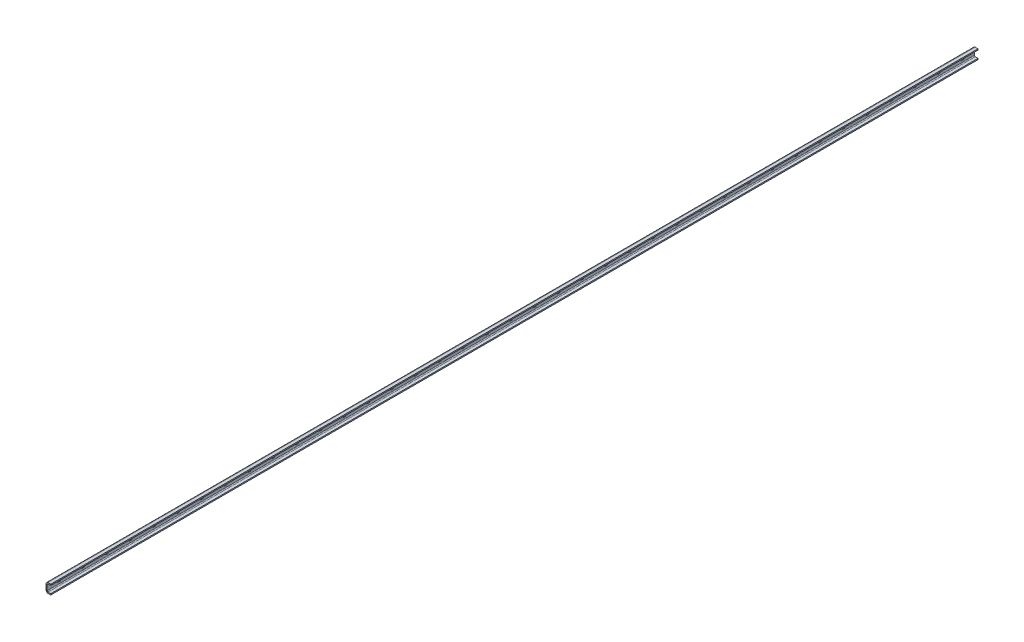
SolidWorks part; units mm, degrees
ref_plane "Front Plane" through (0, 0, 0) normal (0, 0, 1) x (1, 0, 0)
ref_plane "Top Plane" through (0, 0, 0) normal (0, 1, 0) x (1, 0, 0)
ref_plane "Right Plane" through (0, 0, 0) normal (1, 0, 0) x (0, 0, -1)
sketch "Sketch1" plane through (0, 0, 0) normal (0, 0, 1) x (1, 0, 0)
  line L0 (16, 11.9) -> (16, 15.9)
  line L1 (16, 15.9) -> (7, 15.9)
  line L2 (0, 8.9) -> (0, -8.9)
  line L3 (7, -15.9) -> (16, -15.9)
  line L4 (16, -15.9) -> (16, -11.9)
  line L5 (16, -11.9) -> (7, -11.9)
  line L6 (4, -8.9) -> (4, 8.9)
  line L7 (7, 11.9) -> (16, 11.9)
  arc A0 (7, 15.9) -> (0, 8.9) centre (7, 8.9) ccw
  arc A1 (0, -8.9) -> (7, -15.9) centre (7, -8.9) ccw
  arc A2 (7, -11.9) -> (4, -8.9) centre (7, -8.9) cw
  arc A3 (4, 8.9) -> (7, 11.9) centre (7, 8.9) cw
  dimension "D1" = 7
  dimension "D2" = 3
  dimension "D3" = 16
  dimension "D4" = 11.9
  dimension "D5" = 11.9
extrude "Extrude1" add sketch "Sketch1" against normal blind 3120
sketch "Sketch2" plane through (4, 0, 0) normal (1, 0, 0) x (0, 0, -1)
  line L0 (37.5, 0) -> (42.5, 0) construction
  line L1 (37.5, 3) -> (42.5, 3)
  line L2 (37.5, -3) -> (42.5, -3)
  arc A0 (37.5, 3) -> (37.5, -3) centre (37.5, 0) ccw
  arc A1 (42.5, 3) -> (42.5, -3) centre (42.5, 0) cw
  point P7 (40, 0)
  dimension "D1" = 5
  dimension "D2" = 6
  dimension "D3" = 40
extrude "Extrude2" cut sketch "Sketch2" against normal through all
pattern_linear "LPattern1" count 39 spacing 80 along (0, 0, -1) of "Extrude2"
